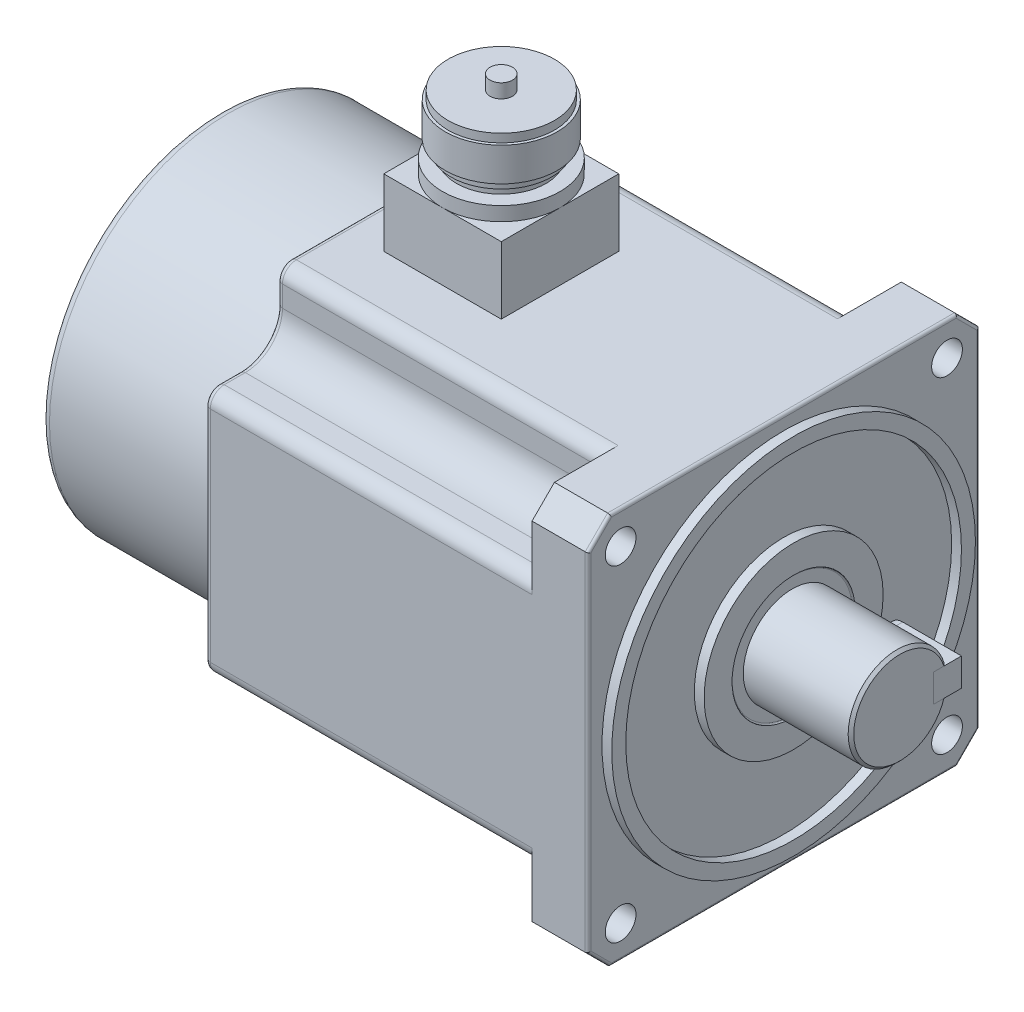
SolidWorks part; units mm, degrees
ref_plane "前视基准面" through (0, 0, 0) normal (0, 0, 1) x (1, 0, 0)
ref_plane "上视基准面" through (0, 0, 0) normal (0, 1, 0) x (1, 0, 0)
ref_plane "右视基准面" through (0, 0, 0) normal (1, 0, 0) x (0, 0, -1)
sketch "草图1" plane through (0, 0, 0) normal (1, 0, 0) x (0, 0, -1)
  line L0 (-70, 62) -> (-62, 70)
  line L1 (-62, -70) -> (62, -70)
  line L2 (-70, -62) -> (-70, 62)
  line L3 (-62, 70) -> (62, 70)
  line L4 (70, -62) -> (70, 62)
  line L5 (-70, -70) -> (70, 70) construction
  line L6 (-70, 70) -> (70, -70) construction
  line L7 (-62, -70) -> (-70, -62)
  line L8 (62, -70) -> (70, -62)
  line L9 (70, 62) -> (62, 70)
  point P0 (0, 0)
extrude "凸台-拉伸1" add sketch "草图1" against normal blind 137
sketch "草图2" plane through (-137, 0, 0) normal (-1, 0, 0) x (0, 0, 1)
  line L0 (-57.5, 44.2147) -> (-65, 44.2147)
  line L1 (-70, -62) -> (-70, 62) construction
  line L3 (-65, -44.2147) -> (-57.5, -44.2147)
  line L4 (-70, 39.2147) -> (-70, 62)
  line L5 (-44.2147, -57.5) -> (-44.2147, -65)
  line L6 (62, -70) -> (-62, -70) construction
  line L8 (44.2147, -65) -> (44.2147, -57.5)
  line L9 (-70, 62) -> (-62, 70)
  line L10 (57.5, -44.2147) -> (65, -44.2147)
  line L11 (70, 62) -> (70, -62) construction
  line L13 (65, 44.2147) -> (57.5, 44.2147)
  line L14 (-62, 70) -> (-39.2147, 70)
  line L15 (44.2147, 57.5) -> (44.2147, 65)
  line L16 (-62, 70) -> (62, 70) construction
  line L18 (-44.2147, 65) -> (-44.2147, 57.5)
  line L19 (39.2147, 70) -> (62, 70)
  line L20 (62, 70) -> (70, 62)
  line L21 (70, 62) -> (70, 39.2147)
  line L22 (70, -39.2147) -> (70, -62)
  line L23 (70, -62) -> (62, -70)
  line L24 (62, -70) -> (39.2147, -70)
  line L25 (-39.2147, -70) -> (-62, -70)
  line L26 (-62, -70) -> (-70, -62)
  line L27 (-70, -62) -> (-70, -39.2147)
  arc A0 (-57.5, 44.2147) -> (-44.2147, 57.5) centre (-57.5, 57.5) ccw
  arc A1 (44.2147, 57.5) -> (57.5, 44.2147) centre (57.5, 57.5) ccw
  arc A2 (57.5, -44.2147) -> (44.2147, -57.5) centre (57.5, -57.5) ccw
  arc A3 (-44.2147, -57.5) -> (-57.5, -44.2147) centre (-57.5, -57.5) ccw
  arc A4 (-65, 44.2147) -> (-70, 39.2147) centre (-65, 39.2147) ccw
  arc A5 (-70, -39.2147) -> (-65, -44.2147) centre (-65, -39.2147) ccw
  arc A6 (-44.2147, -65) -> (-39.2147, -70) centre (-39.2147, -65) ccw
  arc A7 (39.2147, -70) -> (44.2147, -65) centre (39.2147, -65) ccw
  arc A8 (65, -44.2147) -> (70, -39.2147) centre (65, -39.2147) ccw
  arc A9 (70, 39.2147) -> (65, 44.2147) centre (65, 39.2147) ccw
  arc A10 (44.2147, 65) -> (39.2147, 70) centre (39.2147, 65) ccw
  arc A11 (-39.2147, 70) -> (-44.2147, 65) centre (-39.2147, 65) ccw
  point P0 (0, 0)
  point P10 (-70, 44.2147)
  point P39 (-70, -44.2147)
  point P42 (-44.2147, -70)
  point P45 (44.2147, -70)
  point P48 (70, -44.2147)
  point P51 (70, 44.2147)
  point P54 (44.2147, 70)
  point P57 (-44.2147, 70)
  dimension "D1" = 5
extrude "切除-拉伸1" cut sketch "草图2" against normal blind 117
fillet "圆角1" radius 2 24 edges at (-137, 48.1059, 48.1059) (-137, 44.2147, 61.25) (-137, 42.7502, 68.5355) (-137, 0, 70) (-137, -42.7502, 68.5355) (-137, -44.2147, 61.25) (-137, -48.1059, 48.1059) (-137, -61.25, 44.2147) (-137, -68.5355, 42.7502) (-137, -70, 0) (-137, -68.5355, -42.7502) (-137, -61.25, -44.2147) (-137, -48.1059, -48.1059) (-137, -44.2147, -61.25) (-137, -42.7502, -68.5355) (-137, 0, -70) (-137, 42.7502, -68.5355) (-137, 44.2147, -61.25) (-137, 48.1059, -48.1059) (-137, 61.25, -44.2147) (-137, 68.5355, -42.7502) (-137, 70, 0) (-137, 68.5355, 42.7502) (-137, 61.25, 44.2147)
fillet "圆角2" radius 1 8 edges at (0, 66, -66) (0, 0, -70) (0, -66, -66) (0, -70, 0) (0, -66, 66) (0, 0, 70) (0, 66, 66) (0, 70, 0)
sketch "草图4" plane through (0, 0, 0) normal (1, 0, 0) x (0, 0, -1)
  circle A1 centre (-58.3363, 58.3363) radius 5.5
  circle A2 centre (58.3363, 58.3363) radius 5.5
  circle A3 centre (58.3363, -58.3363) radius 5.5
  circle A4 centre (-58.3363, -58.3363) radius 5.5
extrude "切除-拉伸2" cut sketch "草图4" against normal blind 20
sketch "草图5" plane through (0, 0, 0) normal (1, 0, 0) x (0, 0, -1)
  circle A0 centre (0, 0) radius 65
  circle A1 centre (0, 0) radius 60
extrude "凸台-拉伸2" add sketch "草图5" along normal blind 3.5
sketch "草图6" plane through (0, 0, 0) normal (1, 0, 0) x (0, 0, -1)
  circle A0 centre (0, 0) radius 32
extrude "凸台-拉伸3" add sketch "草图6" along normal blind 3.5
sketch "草图7" plane through (3.5, 0, 0) normal (1, 0, 0) x (0, 0, -1)
  circle A0 centre (0, 0) radius 22
extrude "切除-拉伸3" cut sketch "草图7" against normal blind 0.5
fillet "圆角3" radius 0.5 1 edges at (3, 0, -22)
sketch "草图8" plane through (3, 0, 0) normal (1, 0, 0) x (0, 0, -1)
  circle A0 centre (0, 0) radius 17.5
extrude "凸台-拉伸4" add sketch "草图8" along normal blind 38.5
ref_plane "基准面1" through (0, 0, -17.5) normal (0, 0, 1) x (1, 0, 0)
sketch "草图9" plane through (0, 0, -17.5) normal (0, 0, 1) x (1, 0, 0)
  line L1 (41.5, -17.5) -> (41.5, 17.5) construction
  line L2 (20.5, 5) -> (41.5, 5)
  line L3 (41.5, 5) -> (41.5, -5)
  line L4 (41.5, -5) -> (20.5, -5)
  arc A0 (20.5, 5) -> (20.5, -5) centre (20.5, 0) ccw
extrude "切除-拉伸4" cut sketch "草图9" along normal blind 5.5
sketch "草图10" plane through (0, 0, -12) normal (0, 0, -1) x (-1, 0, 0)
  line L0 (-20.5, 5) -> (-41.5, 5)
  line L1 (-41.5, 5) -> (-41.5, -5)
  line L2 (-41.5, -5) -> (-20.5, -5)
  arc A0 (-20.5, -5) -> (-20.5, 5) centre (-20.5, 0) ccw
extrude "凸台-拉伸5" add sketch "草图10" along normal blind 10 separate body
sketch "草图11" plane through (-137, 0, 0) normal (-1, 0, 0) x (0, 0, 1)
  circle A0 centre (0, 0) radius 64
extrude "凸台-拉伸6" add sketch "草图11" along normal blind 64.5
fillet "圆角4" radius 3 1 edges at (-201.5, 0, 64)
chamfer "倒角1" distance 1 angle 45 1 edges at (41.5, 0, 17.5)
sketch "草图12" plane through (0, 70, 0) normal (0, 1, 0) x (1, 0, 0)
  line L3 (-122, -21) -> (-80, -21)
  line L4 (-122, -21) -> (-122, 21)
  line L5 (-122, 21) -> (-80, 21)
  line L6 (-80, -21) -> (-80, 21)
  line L7 (-122, -21) -> (-80, 21) construction
  line L8 (-122, 21) -> (-80, -21) construction
extrude "凸台-拉伸7" add sketch "草图12" along normal blind 24
sketch "草图13" plane through (0, 94, 0) normal (0, 1, 0) x (1, 0, 0)
  circle A0 centre (-101, 0) radius 21
extrude "凸台-拉伸8" add sketch "草图13" along normal blind 5
sketch "草图14" plane through (0, 99, 0) normal (0, 1, 0) x (1, 0, 0)
  circle A0 centre (-101, 0) radius 16
extrude "凸台-拉伸9" add sketch "草图14" along normal blind 3
sketch "草图15" plane through (0, 102, 0) normal (0, 1, 0) x (1, 0, 0)
  circle A0 centre (-101, 0) radius 18
extrude "凸台-拉伸10" add sketch "草图15" along normal blind 3
sketch "草图16" plane through (0, 105, 0) normal (0, 1, 0) x (1, 0, 0)
  circle A0 centre (-101, 0) radius 20
extrude "凸台-拉伸11" add sketch "草图16" along normal blind 12
sketch "草图17" plane through (0, 117, 0) normal (0, 1, 0) x (1, 0, 0)
  circle A0 centre (-101, 0) radius 19
extrude "凸台-拉伸12" add sketch "草图17" along normal blind 3
sketch "草图18" plane through (0, 120, 0) normal (0, 1, 0) x (1, 0, 0)
  circle A0 centre (-101, 0) radius 4
extrude "凸台-拉伸13" add sketch "草图18" along normal blind 5
